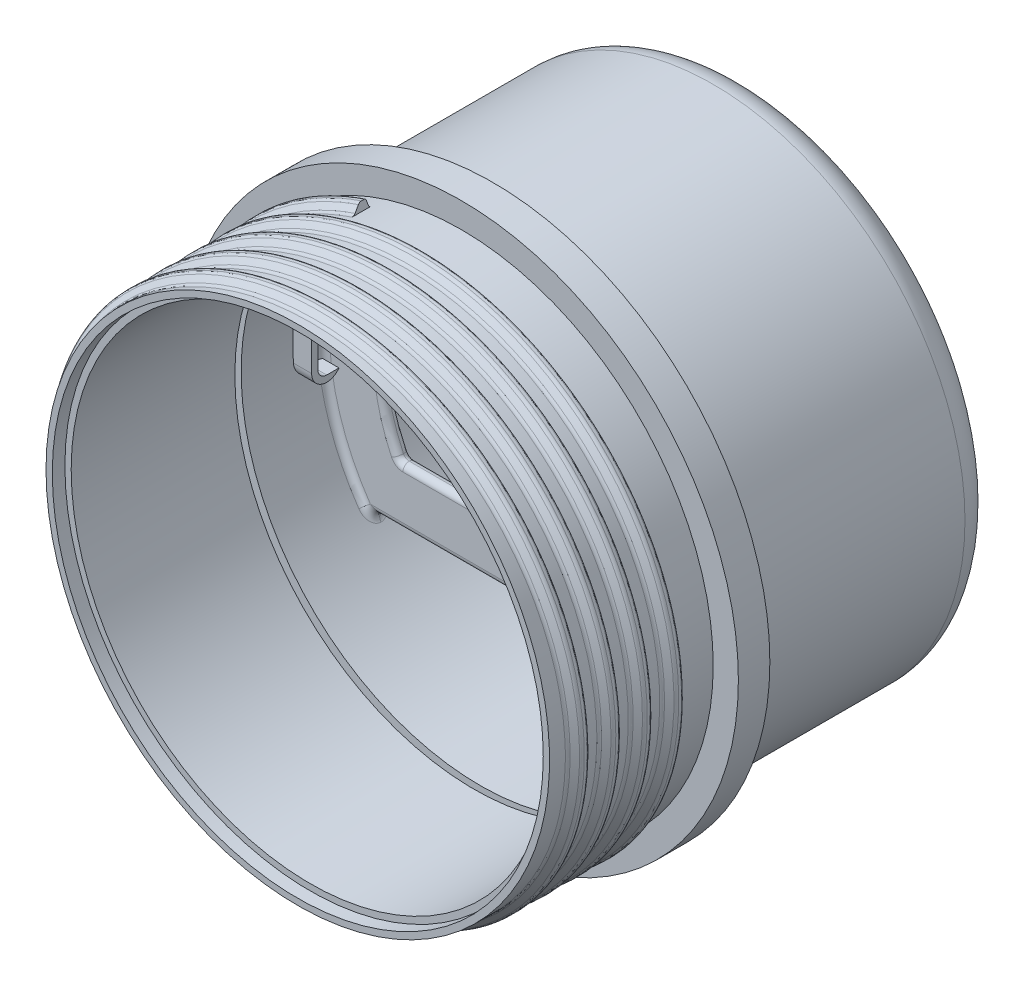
SolidWorks part; units mm, degrees
ref_plane "Front Plane" through (0, 0, 0) normal (0, 0, 1) x (1, 0, 0)
ref_plane "Top Plane" through (0, 0, 0) normal (0, 1, 0) x (1, 0, 0)
ref_plane "Right Plane" through (0, 0, 0) normal (1, 0, 0) x (0, 0, -1)
sketch "Sketch1" plane through (0, 0, 0) normal (0, 0, 1) x (1, 0, 0)
  circle A0 centre (0, 0) radius 40
extrude "box_out" add sketch "Sketch1" along normal blind 40
sketch "Sketch6" plane through (0, 0, 40) normal (0, 0, 1) x (1, 0, 0)
  circle A0 centre (0, 0) radius 44
extrude "middle" add sketch "Sketch6" along normal blind 5
sketch "Sketch7" plane through (0, 0, 45) normal (0, 0, 1) x (1, 0, 0)
  circle A0 centre (0, 0) radius 40
extrude "box_in" add sketch "Sketch7" along normal blind 26
shell "Shell1" thickness 2
thread "Thread1" pitch 4.2333 start angle 0, offset 0, length 21, pitch 5, diameter 80
ref_plane "Plane1" through (-40, 0, 71) normal (0, -1, 0) x (-1, 0, 0)
sketch "Thread Profile1" plane through (-40, 0, 71) normal (0, -1, 0) x (-1, 0, 0)
  line L0 (0, 0) -> (0, 4.2333) construction
  line L1 (0, 0) -> (0, 2.9164)
  line L2 (0.254, 2.9164) -> (1.1938, 2.9164) construction
  line L3 (1.1938, 2.2796) -> (1.1938, 1.8251)
  line L4 (0.9839, 2.5297) -> (0.2099, 2.6662)
  line L5 (0.9706, 1.2862) -> (0.2232, 0.5388)
  line L6 (0.762, 0) -> (1.1938, 0) construction
  arc A0 (0.2099, 2.6662) -> (0, 2.9164) centre (0.254, 2.9164) cw
  arc A1 (0.2232, 0.5388) -> (0, 0) centre (0.762, 0) ccw
  arc A2 (1.1938, 1.8251) -> (0.9706, 1.2862) centre (0.4318, 1.8251) cw
  arc A3 (1.1938, 2.2796) -> (0.9839, 2.5297) centre (0.9398, 2.2796) ccw
  point P10 (1.1938, 2.4927)
  point P17 (1.1938, 1.5094)
  point P18 (0, 2.7032)
  point P19 (0, 0.3156)
  point P20 (0, 0)
  dimension "RootFillet1" = 0.254
  dimension "RootFillet2" = 0.762
  dimension "CrestFillet2" = 0.762
  dimension "CrestFillet1" = 0.254
  dimension "Pitch" = 4.2333
  dimension "Angle1" = 10
  dimension "Angle2" = 45
  dimension "a" = 2.3876
  dimension "b" = 1.1938
  dimension "c" = 0.9833
fillet "Fillet1" radius 5 1 edges at (40, 0, 0)
sketch "Sketch23" plane through (0, 0, 0) normal (0, 0, -1) x (-1, 0, 0)
  text T0 "<b>            </b>  <b>  </b>   Hypertronics     <b>                                          </b>" font "@Adobe Heiti Std R" height 6
extrude "Hypertronics" add sketch "Sketch23" along normal blind 1
sketch "Sketch8" plane through (0, 0, 0) normal (0, 0, -1) x (-1, 0, 0)
  line L1 (12.5, 7) -> (-12.5, 7)
  line L2 (12.5, 7) -> (12.5, -7)
  line L3 (12.5, -7) -> (-12.5, -7)
  line L4 (-12.5, 7) -> (-12.5, -7)
  line L5 (12.5, 7) -> (-12.5, -7) construction
  line L6 (12.5, -7) -> (-12.5, 7) construction
  point P0 (0, 0)
extrude "display_screen" cut sketch "Sketch8" against normal through all contours L2 L1 L4 L3
sketch "Sketch9" plane through (0, 0, 2) normal (0, 0, 1) x (1, 0, 0)
  line L0 (12.5, -7) -> (12.5, 7) construction
  line L1 (12.5, 7) -> (-12.5, 7) construction
  line L2 (12.5, -7) -> (-12.5, -7) construction
  line L3 (0, 0) -> (0, -44) construction
  line L4 (0, 0) -> (0, 44) construction
  circle A0 centre (11.25, 9) radius 2
  circle A1 centre (11.25, -13) radius 2
  circle A2 centre (0, 0) radius 44 construction
  circle A3 centre (-11.25, 9) radius 2
  circle A4 centre (-11.25, -13) radius 2
extrude "screw" add sketch "Sketch9" along normal blind 2
sketch "Sketch10" plane through (0, 0, 4) normal (0, 0, 1) x (1, 0, 0)
  line L0 (0, 0) -> (0, -44) construction
  circle A0 centre (11.25, 9) radius 0.75
  circle A1 centre (11.25, -13) radius 0.75
  circle A2 centre (11.25, 9) radius 2 construction
  circle A3 centre (11.25, -13) radius 2 construction
  circle A4 centre (0, 0) radius 44 construction
  circle A5 centre (-11.25, -13) radius 0.75
  circle A6 centre (-11.25, 9) radius 0.75
extrude "screw_hole" cut sketch "Sketch10" against normal blind 2.5 contours A0 | A1 | A5 | A6
ref_plane "Plane3" through (0, 0, 27) normal (0, 0, 1) x (1, 0, 0)
sketch "Sketch20" plane through (0, 0, 27) normal (0, 0, 1) x (1, 0, 0)
  line L1 (-30.9839, 22) -> (5, 22)
  line L3 (-30.9839, -22) -> (5, -22)
  line L4 (5, 22) -> (5, -22)
  arc A0 (-30.9839, 22) -> (-30.9839, -22) centre (0, 0) ccw
extrude "Boss-Extrude7" add sketch "Sketch20" along normal blind 2
sketch "Sketch21" plane through (0, 0, 29) normal (0, 0, 1) x (1, 0, 0)
  line L6 (-4, -13) -> (-4, 13)
  line L7 (-4, 13) -> (-25.923, 13)
  line L8 (-25.923, -13) -> (-4, -13)
  line L9 (-4, -13) -> (-4, 13)
  line L10 (-4, 13) -> (-25.923, 13)
  line L11 (-25.923, -13) -> (-4, -13)
  arc A2 (-25.923, 13) -> (-25.923, -13) centre (0, 0) ccw
  arc A3 (-25.923, 13) -> (-25.923, -13) centre (0, 0) ccw
  dimension "D1" = 9
extrude "Cut-Extrude4" cut sketch "Sketch21" against normal blind 2
ref_plane "Plane4" through (-40, 0, 0) normal (1, 0, 0) x (0, 0, -1)
sketch "Sketch26" plane through (-40, 0, 0) normal (1, 0, 0) x (0, 0, -1)
  line L0 (-31.4, 2.9) -> (-31.4, -2.9) construction
  line L1 (-30, 2.9) -> (-30, -2.9)
  line L2 (-32.8, 2.9) -> (-32.8, -2.9)
  line L3 (0, -35) -> (0, 35) construction
  line L4 (-40, -40) -> (-5, -40) construction
  arc A0 (-30, 2.9) -> (-32.8, 2.9) centre (-31.4, 2.9) ccw
  arc A1 (-32.8, -2.9) -> (-30, -2.9) centre (-31.4, -2.9) ccw
  point P2 (-31.4, 0)
  point P9 (-31.4, 4.3)
  point P10 (-31.4, -4.3)
extrude "Cut-Extrude11" cut sketch "Sketch26" along normal blind 5 contours L2 A1 L1 A0
sketch "Sketch27" plane through (-40, 0, 0) normal (1, 0, 0) x (0, 0, -1)
  line L0 (-32.8, -2.9) -> (-32.8, 2.9) construction
  line L1 (-30, 2.9) -> (-30, -2.9) construction
  line L2 (-32.8, -2.9) -> (-32.8, 2.9)
  line L3 (-30, 2.9) -> (-30, -2.9)
  line L4 (-31.4, 2.9) -> (-31.4, -2.9) construction
  line L6 (-33.8, 2.9) -> (-33.8, -2.9)
  line L7 (-31.4, 4.3) -> (-29.4506, 4.3)
  line L9 (-31.4, -4.3) -> (-29.4506, -4.3)
  arc A0 (-32.8, -2.9) -> (-30, -2.9) centre (-31.4, -2.9) ccw construction
  arc A1 (-30, 2.9) -> (-32.8, 2.9) centre (-31.4, 2.9) ccw construction
  arc A2 (-32.8, -2.9) -> (-30, -2.9) centre (-31.4, -2.9) ccw
  arc A3 (-30, 2.9) -> (-32.8, 2.9) centre (-31.4, 2.9) ccw
  arc A4 (-29.4506, 4.3) -> (-33.8, 2.9) centre (-31.4, 2.9) ccw
  arc A5 (-33.8, -2.9) -> (-29.4506, -4.3) centre (-31.4, -2.9) ccw
  point P3 (-31.4, 0)
extrude "Boss-Extrude10" add sketch "Sketch27" along normal blind 5 contours L6 A5 L9 A2 L2 A3 L7 A4
sketch "Sketch28" plane through (0, 0, 2) normal (0, 0, 1) x (1, 0, 0)
  line L0 (44, 0) -> (-44, 0) construction
  circle A0 centre (29.2404, -13) radius 4
  circle A2 centre (0, 0) radius 44 construction
  circle A3 centre (29.2404, 13) radius 4
extrude "mounting hole pcb" add sketch "Sketch28" along normal blind 43
sketch "Sketch29" plane through (0, 0, 45) normal (0, 0, 1) x (1, 0, 0)
  circle A0 centre (29.2404, 13) radius 0.75
  circle A1 centre (29.2404, -13) radius 0.75
extrude "pcb_screw" cut sketch "Sketch29" against normal blind 20
sketch "Sketch30" plane through (0, 0, 0) normal (0, 0, -1) x (-1, 0, 0)
  line L0 (0, 0) -> (0, -35) construction
  line L5 (12.5, -7) -> (-12.5, -7) construction
  line L6 (5, -22) -> (-5, -22)
  line L7 (5, -22) -> (5, -27)
  line L8 (5, -27) -> (-5, -27)
  line L9 (-5, -22) -> (-5, -27)
  line L10 (5, -22) -> (-5, -27) construction
  line L11 (5, -27) -> (-5, -22) construction
  circle A0 centre (0, 0) radius 35 construction
  point P0 (0, -24.5)
  point P11 (0, -22)
extrude "Cut-Extrude13" cut sketch "Sketch30" against normal blind 5 contours L7 L6 L9 L8
sketch "Sketch31" plane through (0, 0, 71) normal (0, 0, 1) x (1, 0, 0)
  circle A0 centre (0, 0) radius 39
extrude "Cut-Extrude14" cut sketch "Sketch31" against normal blind 2
chamfer "Chamfer1" distance 5 angle 80 2 edges at (25.2404, 13, 2) (33.2404, -13, 2)
fillet "Fillet4" radius 2 8 edges at (5, -24.5, 0) (0, -22, 0) (0, -27, 0) (-5, -24.5, 0) (-12.5, 0, 0) (0, 7, 0) (12.5, 0, 0) (0, -7, 0)
fillet "Fillet5" radius 1 16 edges at (-38, 0, 29) (-38, 0, 27) (-12.9919, 22, 29) (-12.9919, 22, 27) (-14.9615, 13, 27) (-14.9615, 13, 29) (-4, 0, 27) (-4, 0, 29) (-14.9615, -13, 27) (-14.9615, -13, 29) (5, 0, 29) (5, 0, 27) (-12.9919, -22, 29) (-12.9919, -22, 27) (-29, 0, 27) (-29, 0, 29)
equation "\"diameter\"=80"
equation "\"D1@Sketch1\"=\"diameter\""
equation "\"height\"= 40"
equation "\"thick\"= 2"
equation "\"D1@box_out\" = \"height\""
equation "\"D1@Sketch6\"=\"diameter\"+4*(\"thick\")"
equation "\"D1@Sketch7\"=\"diameter\""
equation "\"lid_height\"= 27"
equation "\"D1@box_in\" = \"lid_height\" - 1"
equation "\"D1@Shell1\"=\"thick\""
equation "\"dis_width\"= 25"
equation "\"D1@Sketch8\"=\"dis_width\""
equation "\"dis_height\"= 14"
equation "\"D2@Sketch8\"=\"dis_height\""
equation "\"dis_screw_out\"=4"
equation "\"D1@Sketch9\"=\"dis_screw_out\""
equation "\"D2@Sketch9\"=\"dis_screw_out\""
equation "\"dis_offset\"=2"
equation "\"D1@screw\" = \"dis_offset\""
equation "\"dis_screw_in\"=1.5"
equation "\"D1@Sketch10\"=\"dis_screw_in\""
equation "\"D2@Sketch10\"=\"dis_screw_in\""
equation "\"dis_screw_depth\"=3"
equation "\"tray_width\"=40"
equation "\"top_to_tray\"=20"
equation "\"battery_width\"=50"
equation "\"D1@Sketch20\"=\"diameter\"-2*(\"thick\")"
equation "\"battery_len\"=60"
equation "\"D3@Sketch20\"=\"tray_width\"+2*(\"thick\")"
equation "\"D4@Sketch20\"=(\"tray_width\"+2*(\"thick\"))/2"
equation "\"D1@Boss-Extrude7\"=\"thick\""
equation "\"D1@Cut-Extrude4\"=\"thick\""
equation "\"port_h\"=2.8"
equation "\"D3@Sketch26\"=\"port_h\""
equation "\"D4@Sketch26\"=\"diameter\"/2"
equation "\"D1@Sketch27\"=\"thick\"/2"
equation "\"screw_out\"=8"
equation "\"D1@Sketch28\"=\"screw_out\""
equation "\"pcb_gap_screw\"=26"
equation "\"D2@Sketch28\"=\"pcb_gap_screw\"/2"
equation "\"D1@Sketch29\"=\"dis_screw_in\""
equation "\"D2@Sketch29\"=\"dis_screw_in\""
equation "\"switch_len\"=10"
equation "\"switch_width\"=5"
equation "\"D1@Sketch30\"=\"switch_width\""
equation "\"D2@Sketch30\"=\"switch_len\""
equation "\"D1@Sketch31\"=\"diameter\"-\"thick\""
equation "\"D1@Cut-Extrude14\"=\"thick\""
